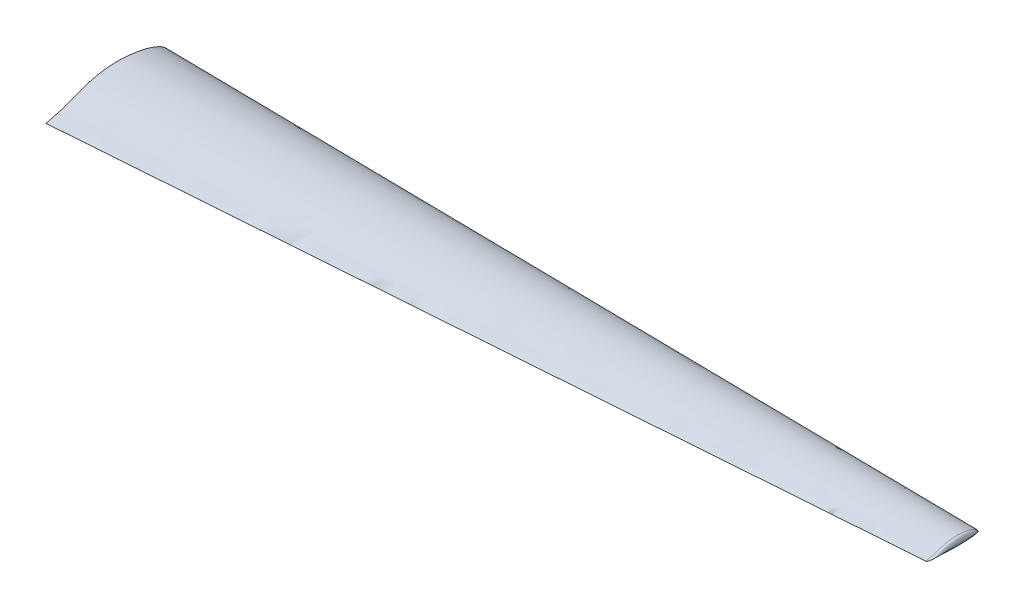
SolidWorks part; units mm, degrees
other "<Aile gauche>-<Dome1>"
ref_plane "Front Plane" through (0, 0, 0) normal (0, 0, 1) x (1, 0, 0)
ref_plane "Top Plane" through (0, 0, 0) normal (0, 1, 0) x (1, 0, 0)
ref_plane "Right Plane" through (0, 0, 0) normal (1, 0, 0) x (0, 0, -1)
mirrored part "Aile gauche_Symétrique"
sketch "Esquisse1" plane through (0, 0, 0) normal (0, 1, 0) x (1, 0, 0)
  line L0 (0, 0) -> (7679.7664, -99.6802) construction
  spline S0 degree 3 number of poles 137 (7700, -99.9433) -> (540, -6.8553) construction
sketch "Esquisse2" plane through (0, 0, 0) normal (0, 1, 0) x (1, 0, 0)
  line L0 (540, -6.8553) -> (540, -1061.0733) construction
  line L1 (0, 0) -> (7679.7664, -99.6802) construction
  point P0 (3678, -239.7551)
  dimension "D1" = 3138
  dimension "D2" = 192
